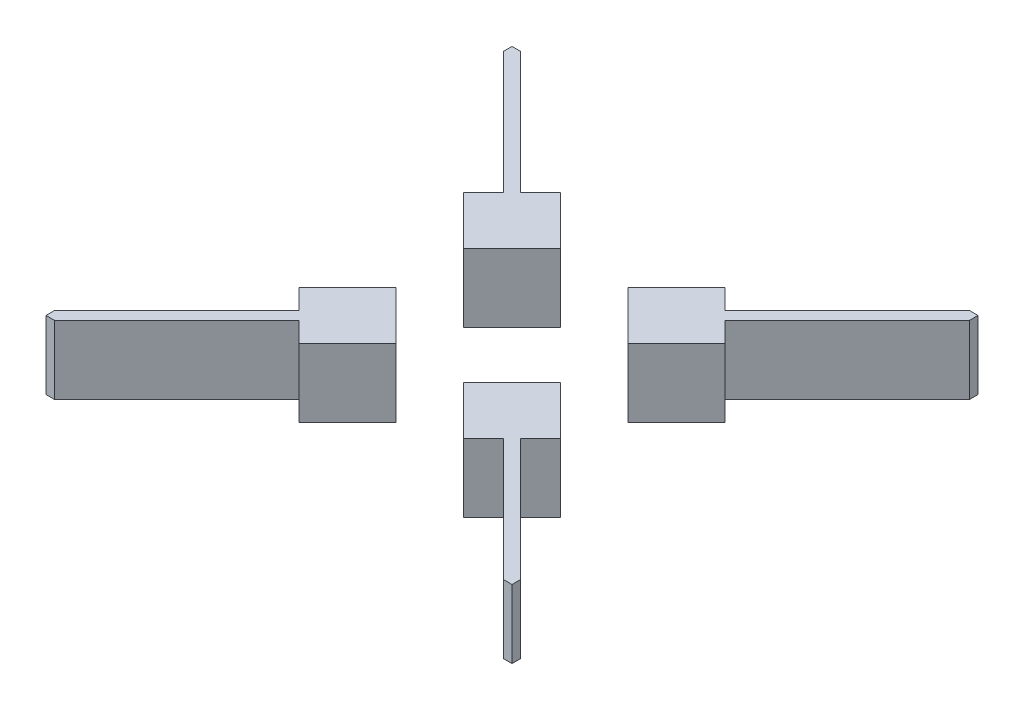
SolidWorks part; units mm, degrees
ref_plane "Front Plane" through (0, 0, 0) normal (0, 0, 1) x (1, 0, 0)
ref_plane "Top Plane" through (0, 0, 0) normal (0, 1, 0) x (1, 0, 0)
ref_plane "Right Plane" through (0, 0, 0) normal (1, 0, 0) x (0, 0, -1)
sketch "Sketch1" plane through (0, 0, 0) normal (0, 1, 0) x (1, 0, 0)
  line L0 (-9.5344, 5.9989) -> (-8.0843, 7.449)
  line L5 (0, -55) -> (0, 55) construction
  line L6 (8.0843, 7.449) -> (7.7667, 7.7667) construction
  line L11 (7.7667, 7.7667) -> (7.449, 8.0843) construction
  line L12 (5.9989, 9.5344) -> (5.9989, 2.4634) construction
  line L13 (-9.5344, 5.9989) -> (-5.9989, 2.4634)
  line L14 (-5.9989, 9.5344) -> (-2.4634, 5.9989)
  line L15 (-5.9989, 2.4634) -> (-2.4634, 5.9989)
  line L16 (-9.5344, 5.9989) -> (-2.4634, 5.9989) construction
  line L17 (-5.9989, 9.5344) -> (-5.9989, 2.4634) construction
  line L18 (-8.0843, 7.449) -> (-17, 16.3647)
  line L19 (-7.449, 8.0843) -> (-16.3647, 17)
  line L21 (9.5344, 5.9989) -> (2.4634, 5.9989) construction
  line L22 (7.449, 8.0843) -> (5.9989, 9.5344)
  line L30 (17, 17) -> (16.3647, 17)
  line L31 (17, 17) -> (17, 16.3647)
  line L32 (7.449, 8.0843) -> (16.3647, 17)
  line L33 (8.0843, 7.449) -> (17, 16.3647)
  line L52 (-17, 17) -> (-17, 16.3647)
  line L53 (-17, 17) -> (-16.3647, 17)
  line L54 (-7.449, 8.0843) -> (-5.9989, 9.5344)
  line L55 (-7.7667, 7.7667) -> (-7.449, 8.0843) construction
  line L56 (-8.0843, 7.449) -> (-7.7667, 7.7667) construction
  line L58 (5.9989, 2.4634) -> (2.4634, 5.9989)
  line L59 (5.9989, 9.5344) -> (2.4634, 5.9989)
  line L61 (9.5344, 5.9989) -> (5.9989, 2.4634)
  line L62 (9.5344, 5.9989) -> (8.0843, 7.449)
  line L64 (-55, 0) -> (55, 0) construction
  line L65 (-8.0843, -7.449) -> (-7.7667, -7.7667) construction
  line L66 (-7.7667, -7.7667) -> (-7.449, -8.0843) construction
  line L67 (9.5344, -5.9989) -> (2.4634, -5.9989) construction
  line L68 (-5.9989, -9.5344) -> (-5.9989, -2.4634) construction
  line L69 (-9.5344, -5.9989) -> (-2.4634, -5.9989) construction
  line L70 (5.9989, -9.5344) -> (5.9989, -2.4634) construction
  line L71 (7.7667, -7.7667) -> (7.449, -8.0843) construction
  line L72 (8.0843, -7.449) -> (7.7667, -7.7667) construction
  line L73 (9.5344, -5.9989) -> (8.0843, -7.449)
  line L74 (9.5344, -5.9989) -> (5.9989, -2.4634)
  line L75 (5.9989, -9.5344) -> (2.4634, -5.9989)
  line L76 (5.9989, -2.4634) -> (2.4634, -5.9989)
  line L77 (-7.449, -8.0843) -> (-5.9989, -9.5344)
  line L78 (-17, -17) -> (-16.3647, -17)
  line L79 (-17, -17) -> (-17, -16.3647)
  line L80 (8.0843, -7.449) -> (17, -16.3647)
  line L81 (7.449, -8.0843) -> (16.3647, -17)
  line L82 (17, -17) -> (17, -16.3647)
  line L83 (17, -17) -> (16.3647, -17)
  line L84 (7.449, -8.0843) -> (5.9989, -9.5344)
  line L85 (-7.449, -8.0843) -> (-16.3647, -17)
  line L86 (-8.0843, -7.449) -> (-17, -16.3647)
  line L87 (-5.9989, -2.4634) -> (-2.4634, -5.9989)
  line L88 (-5.9989, -9.5344) -> (-2.4634, -5.9989)
  line L89 (-9.5344, -5.9989) -> (-5.9989, -2.4634)
  line L90 (-9.5344, -5.9989) -> (-8.0843, -7.449)
  point P0 (0, 0)
  point P12 (-5.9989, 5.9989)
  point P24 (5.9989, 5.9989)
  point P47 (5.9989, -5.9989)
  point P48 (-5.9989, -5.9989)
  point P55 (0, 0)
extrude "Boss-Extrude4" add sketch "Sketch1" along normal blind 5
